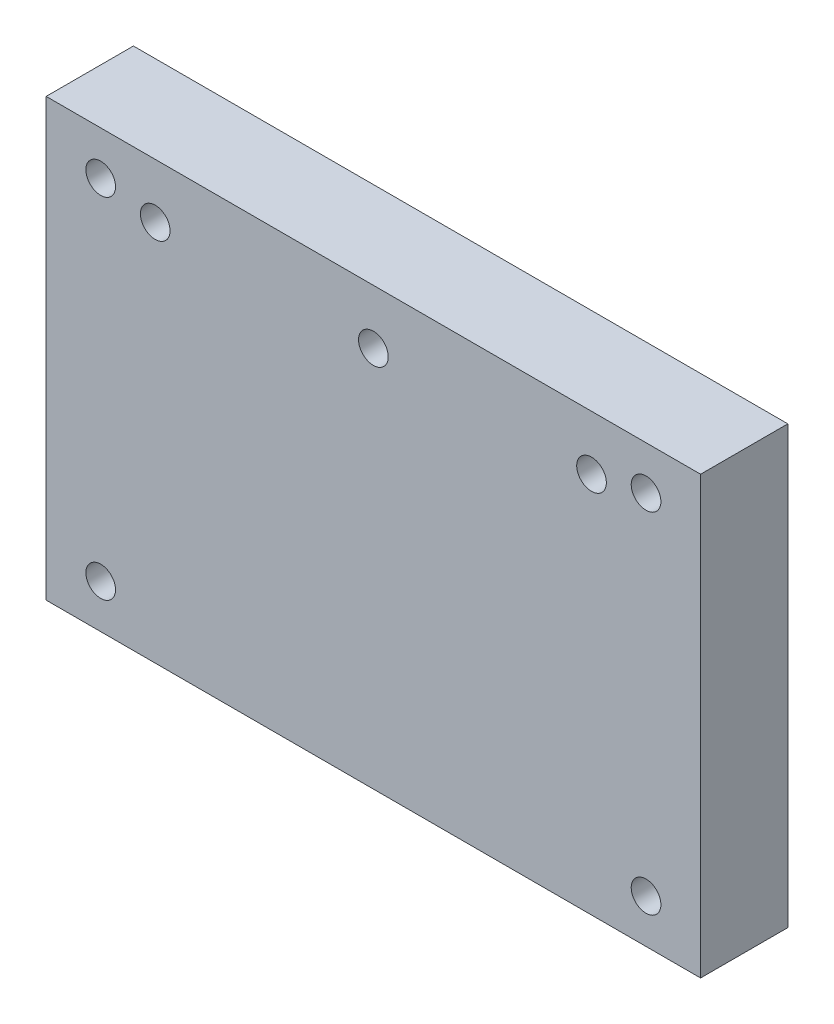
SolidWorks part; units mm, degrees
ref_plane "Plan de face" through (0, 0, 0) normal (0, 0, 1) x (1, 0, 0)
ref_plane "Plan de dessus" through (0, 0, 0) normal (0, 1, 0) x (1, 0, 0)
ref_plane "Plan de droite" through (0, 0, 0) normal (1, 0, 0) x (0, 0, -1)
sketch "Esquisse1" plane through (0, 0, 0) normal (0, 0, 1) x (1, 0, 0)
  line L1 (0, 50) -> (150, 50)
  line L2 (0, 50) -> (0, -50)
  line L3 (0, -50) -> (150, -50)
  line L4 (150, 50) -> (150, -50)
  dimension "D1" = 100
  dimension "D2" = 150
extrude "Extrusion1" add sketch "Esquisse1" along normal blind 20
hole_wizard "Trou taraudé M8x1.251" positions "Esquisse3" profile "Esquisse2" tap size "M8x1.25" standard "ISO"
sketch "Esquisse3" plane through (0, 0, 20) normal (0, 0, 1) x (1, 0, 0)
  line L0 (0, -50) -> (150, -50) construction
  line L1 (0, 50) -> (0, -50) construction
  point P0 (12.5, 40)
  point P1 (137.5, 40)
  point P3 (137.5, -40)
  point P5 (12.5, -40)
  dimension "D1" = 125
  dimension "D2" = 80
  dimension "D3" = 10
  dimension "D4" = 12.5
sketch "Esquisse2" plane through (12.5, 40, 20) normal (1, 0, 0) x (0, -1, 0)
  line L0 (0, 0) -> (0, 20)
  line L1 (0, 20) -> (3.4, 20)
  line L2 (3.4, 20) -> (3.4, 0)
  line L5 (3.4, 0) -> (0, 0)
  line L11 (0, -6.35) -> (0, 107.95) construction
  dimension "Diamètre du trou pour taraudage jusqu'au prochain" = 6.8
  dimension "Profondeur du trou pour taraudage jusqu'au prochain" = 20
hole_wizard "Trou taraudé M81" positions "Esquisse5" profile "Esquisse4" tap size "M8" standard "ISO"
sketch "Esquisse5" plane through (0, 0, 20) normal (0, 0, 1) x (1, 0, 0)
  line L0 (150, 50) -> (0, 50) construction
  line L1 (0, 50) -> (0, -50) construction
  point P0 (75, 37.5)
  point P1 (125, 37.5)
  point P3 (25, 37.5)
  dimension "D1" = 12.5
  dimension "D2" = 25
sketch "Esquisse4" plane through (75, 37.5, 20) normal (1, 0, 0) x (0, -1, 0)
  line L0 (0, 0) -> (0, 20)
  line L1 (0, 20) -> (3.4, 20)
  line L2 (3.4, 20) -> (3.4, 0)
  line L5 (3.4, 0) -> (0, 0)
  line L11 (0, -6.35) -> (0, 107.95) construction
  dimension "Diamètre du trou pour taraudage jusqu'au prochain" = 6.8
  dimension "Profondeur du trou pour taraudage jusqu'au prochain" = 20
